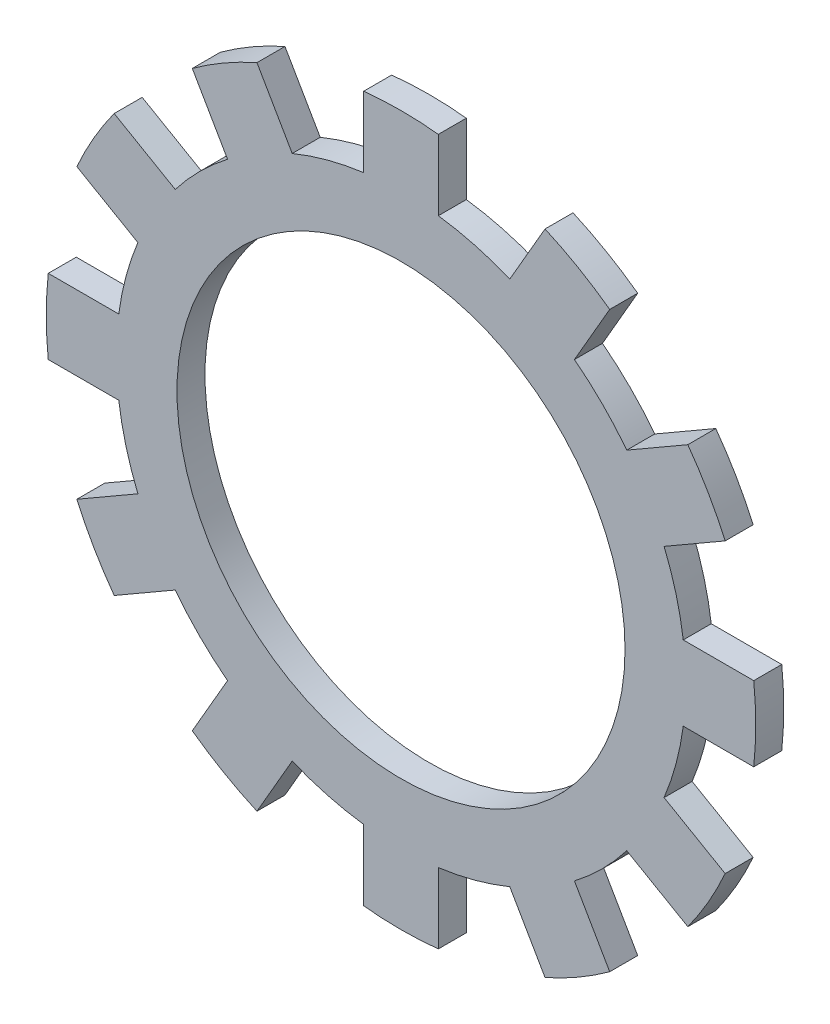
SolidWorks part; units mm, degrees
ref_plane "Front Plane" through (0, 0, 0) normal (0, 0, 1) x (1, 0, 0)
ref_plane "Top Plane" through (0, 0, 0) normal (0, 1, 0) x (1, 0, 0)
ref_plane "Right Plane" through (0, 0, 0) normal (1, 0, 0) x (0, 0, -1)
sketch "Sketch1" plane through (0, 0, 0) normal (0, 0, 1) x (1, 0, 0)
  circle A0 centre (0, 0) radius 12
  circle A1 centre (0, 0) radius 15.25
  dimension "D1" = 24
  dimension "D2" = 30.5
extrude "Boss-Extrude1" add sketch "Sketch1" along normal mid plane 1.5
sketch "Sketch2" plane through (0, 0, 0) normal (0, 0, 1) x (1, 0, 0)
  line L0 (0, 2.6811) -> (0, -2.8425) construction
sketch "Sketch3" plane through (0, 0, 0) normal (0, 0, 1) x (1, 0, 0)
  line L0 (-2, 18.8944) -> (-2, 15.1183)
  line L2 (0, 2.6811) -> (0, -2.8425) construction
  line L3 (0, 15.25) -> (0, 19)
  arc A0 (0, 19) -> (-2, 18.8944) centre (0, 0) ccw
  arc A1 (0, 15.25) -> (-2, 15.1183) centre (0, 0) ccw
  circle A2 centre (0, 0) radius 15.25 construction
  dimension "D2" = 19
  dimension "D1" = 2
extrude "Boss-Extrude2" add sketch "Sketch3" along normal mid plane 1.5
mirror "Mirror1" about plane through (0, 0, 0) normal (1, 0, 0) of "Boss-Extrude2"
pattern_circular "CirPattern2" count 12 over 360 about axis through (0, 0, 0) along (0, 0, 1) of "Boss-Extrude2", "Mirror1"
